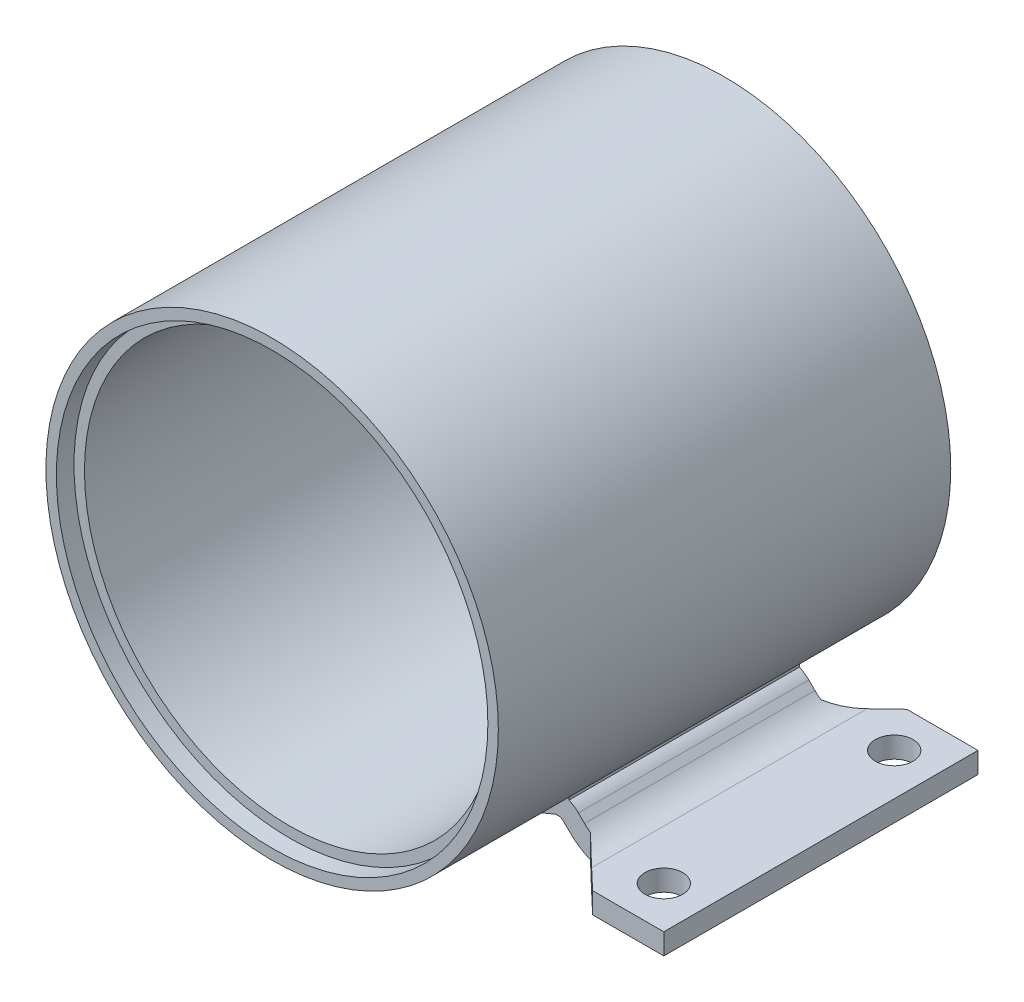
SolidWorks part; units mm, degrees
ref_plane "Plan de face" through (0, 0, 0) normal (0, 0, 1) x (1, 0, 0)
ref_plane "Plan de dessus" through (0, 0, 0) normal (0, 1, 0) x (1, 0, 0)
ref_plane "Plan de droite" through (0, 0, 0) normal (1, 0, 0) x (0, 0, -1)
sketch "Esquisse1" plane through (0, 0, 0) normal (0, 0, 1) x (1, 0, 0)
  circle A0 centre (0, 0) radius 54
  circle A1 centre (0, 0) radius 49
  dimension "D1" = 108
  dimension "D2" = 98
extrude "Extrusion1" add sketch "Esquisse1" along normal blind 108
sketch "Esquisse2" plane through (0, 0, 108) normal (0, 0, 1) x (1, 0, 0)
  circle A0 centre (0, 0) radius 51.5
  dimension "D1" = 103
extrude "Enlèv. mat.-Extru.1" cut sketch "Esquisse2" against normal blind 4.2
sketch "Esquisse3" plane through (0, 0, 0) normal (0, 0, -1) x (-1, 0, 0)
  circle A0 centre (0, 0) radius 51.5
  dimension "D1" = 103
extrude "Enlèv. mat.-Extru.2" cut sketch "Esquisse3" against normal blind 4.2
sketch "Esquisse4" plane through (0, 0, 0) normal (0, 0, -1) x (-1, 0, 0)
  line L0 (0, 0) -> (61.4706, 0) construction
  line L2 (44.6779, 1.5) -> (58.0812, 1.5)
  line L3 (44.6779, 1.5) -> (44.6779, -1.5)
  line L4 (44.6779, -1.5) -> (58.0812, -1.5)
  line L5 (58.0812, 1.5) -> (58.0812, -1.5)
  dimension "D1" = 3
extrude "Enlèv. mat.-Extru.3" cut sketch "Esquisse4" against normal up to surface (4.2 mm away)
sketch "Esquisse5" plane through (0, 0, 0) normal (0, 0, -1) x (-1, 0, 0)
  line L0 (0, 0) -> (0, -67.556) construction
  line L1 (-60.5, -60) -> (-38.6421, -60)
  line L2 (-60.5, -60) -> (-60.5, -55)
  line L3 (-60.5, -55) -> (-38.6421, -55)
  line L4 (-31.5711, -52.0711) -> (-30.1167, -50.6167)
  line L5 (-28.0355, -55.6066) -> (-26.5811, -54.1522)
  line L6 (28.0355, -55.6066) -> (26.5811, -54.1522)
  line L7 (31.5711, -52.0711) -> (30.1167, -50.6167)
  line L8 (60.5, -55) -> (38.6421, -55)
  line L9 (60.5, -60) -> (60.5, -55)
  line L10 (60.5, -60) -> (38.6421, -60)
  arc A0 (53.9792, 1.5) -> (53.9792, -1.5) centre (0, 0) ccw construction
  arc A1 (-22.2789, -49.1899) -> (22.2789, -49.1899) centre (0, 0) ccw
  arc A2 (-24.3418, -53.7446) -> (24.3418, -53.7446) centre (0, 0) ccw
  arc A3 (-28.0355, -55.6066) -> (-38.6421, -60) centre (-38.6421, -45) cw
  arc A4 (-31.5711, -52.0711) -> (-38.6421, -55) centre (-38.6421, -45) cw
  arc A5 (-26.5811, -54.1522) -> (-24.3418, -53.7446) centre (-25.1669, -55.5664) cw
  arc A6 (-30.1167, -50.6167) -> (-22.2789, -49.1899) centre (-25.1669, -55.5664) cw
  arc A7 (30.1167, -50.6167) -> (22.2789, -49.1899) centre (25.1669, -55.5664) ccw
  arc A8 (26.5811, -54.1522) -> (24.3418, -53.7446) centre (25.1669, -55.5664) ccw
  arc A9 (31.5711, -52.0711) -> (38.6421, -55) centre (38.6421, -45) ccw
  arc A10 (28.0355, -55.6066) -> (38.6421, -60) centre (38.6421, -45) ccw
  point P17 (-34.5, -55)
  dimension "D8" = 15
  dimension "D9" = 10
  dimension "D10" = 2
  dimension "D1" = 60
  dimension "D5" = 121
  dimension "D6" = 26
  dimension "D7" = 45
extrude "Extrusion2" add sketch "Esquisse5" against normal blind 75
sketch "Esquisse6" plane through (0, -60, 0) normal (0, -1, 0) x (1, 0, 0)
  line L0 (43.5, 0) -> (-43.5, 0)
  line L1 (60.5, 0) -> (38.6421, 0) construction
  line L2 (-38.6421, 0) -> (-60.5, 0) construction
  line L3 (0, 0) -> (0, 75) construction
  line L4 (43.5, 0) -> (33, 10)
  line L5 (33, 10) -> (-33, 10)
  line L6 (-33, 10) -> (-43.5, 0)
  line L7 (-60.5, 37.5) -> (60.5, 37.5) construction
  line L8 (-60.5, 75) -> (-60.5, 0) construction
  line L9 (60.5, 75) -> (60.5, 0) construction
  line L10 (-33, 65) -> (-43.5, 75)
  line L11 (33, 65) -> (-33, 65)
  line L12 (43.5, 75) -> (33, 65)
  line L13 (43.5, 75) -> (-43.5, 75)
  line L14 (22.2789, 75) -> (-22.2789, 75) construction
  dimension "D1" = 66
  dimension "D2" = 87
  dimension "D3" = 55
extrude "Enlèv. mat.-Extru.4" cut sketch "Esquisse6" against normal up to surface (28.0039 mm away)
sketch "Esquisse7" plane through (0, 0, 10) normal (0, 0, -1) x (-1, 0, 0)
  line L0 (27.858, -46.2594) -> (27.858, -49.1044)
  line L1 (-27.858, -46.2594) -> (-27.858, -49.1044)
  line L2 (0, 0) -> (0, -64.3893) construction
  arc A0 (53.9792, 1.5) -> (53.9792, -1.5) centre (0, 0) ccw construction
  arc A1 (30.1167, -50.6167) -> (22.2789, -49.1899) centre (25.1669, -55.5664) ccw construction
  arc A2 (22.2789, -49.1899) -> (27.858, -46.2594) centre (0, 0) ccw
  arc A3 (27.858, -49.1044) -> (22.2789, -49.1899) centre (25.1669, -55.5664) ccw
  arc A4 (-27.858, -49.1044) -> (-22.2789, -49.1899) centre (-25.1669, -55.5664) cw
  arc A5 (-22.2789, -49.1899) -> (-27.858, -46.2594) centre (0, 0) cw
extrude "Extrusion3" add sketch "Esquisse7" against normal up to surface (55 mm away)
sketch "Esquisse8" plane through (0, -60, 0) normal (0, -1, 0) x (1, 0, 0)
  line L0 (0, 0) -> (0, 75.2931) construction
  line L1 (60.5, 37.5) -> (-60.5, 37.5) construction
  line L2 (60.5, 75) -> (60.5, 0) construction
  line L3 (-60.5, 75) -> (-60.5, 0) construction
  circle A0 centre (50.5, 10) radius 4.5
  circle A1 centre (-50.5, 10) radius 4.5
  circle A2 centre (-50.5, 65) radius 4.5
  circle A3 centre (50.5, 65) radius 4.5
  dimension "D1" = 9
  dimension "D2" = 101
  dimension "D3" = 55
extrude "Enlèv. mat.-Extru.5" cut sketch "Esquisse8" against normal blind 5
